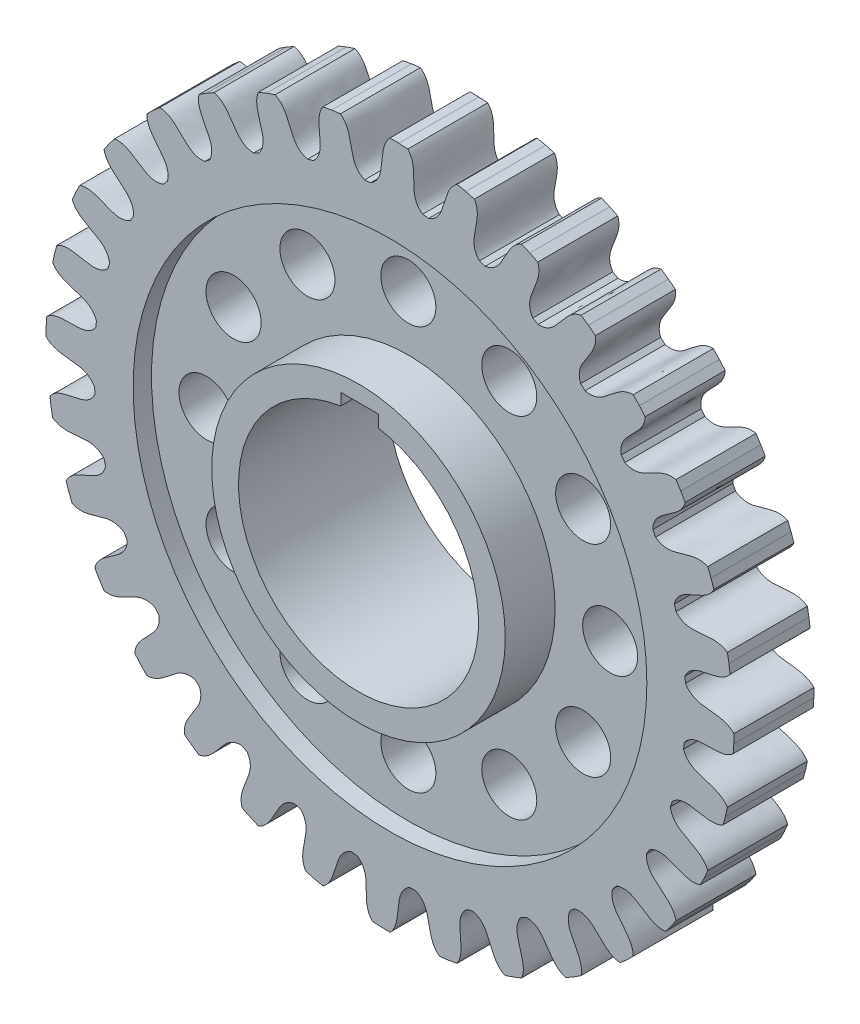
SolidWorks part; units mm, degrees
ref_plane "Ebene vorne" through (0, 0, 0) normal (0, 0, 1) x (1, 0, 0)
ref_plane "Ebene oben" through (0, 0, 0) normal (0, 1, 0) x (1, 0, 0)
ref_plane "Ebene rechts" through (0, 0, 0) normal (1, 0, 0) x (0, 0, -1)
ref_plane "Ebene1" through (0, 0, 13.081) normal (0, 0, 1) x (1, 0, 0)
sketch "Skizze1" plane through (0, 0, 13.081) normal (0, 0, 1) x (1, 0, 0)
  line L0 (22.8551, 51.3844) -> (21.5214, 51.9571)
  line L1 (13.7916, 54.4737) -> (12.3913, 54.8559)
  line L2 (12.3913, 54.8559) -> (10.9715, 55.1574)
  line L3 (2.8993, 56.1176) -> (1.4514, 56.2193)
  line L4 (1.4514, 56.2193) -> (0, 56.238)
  line L5 (-8.1044, 55.6049) -> (-9.5444, 55.4222)
  line L6 (-9.5444, 55.4222) -> (-10.9715, 55.1574)
  line L7 (-18.7967, 52.9554) -> (-20.1733, 52.4952)
  line L8 (-20.1733, 52.4952) -> (-21.5214, 51.9571)
  line L9 (-28.7666, 48.2708) -> (-30.027, 47.5509)
  line L10 (-30.027, 47.5509) -> (-31.2442, 46.7602)
  line L11 (-37.631, 41.7312) -> (-38.7268, 40.7793)
  line L12 (-38.7268, 40.7793) -> (-39.7663, 39.7663)
  line L13 (-45.0493, 33.5879) -> (-45.9383, 32.4405)
  line L14 (-45.9383, 32.4405) -> (-46.7602, 31.2442)
  line L15 (-50.7364, 24.1539) -> (-51.3844, 22.8551)
  line L16 (-51.3844, 22.8551) -> (-51.9571, 21.5214)
  line L17 (-54.4737, 13.7916) -> (-54.8559, 12.3913)
  line L18 (-54.8559, 12.3913) -> (-55.1574, 10.9715)
  line L19 (-56.1176, 2.8993) -> (-56.2193, 1.4514)
  line L20 (-56.2193, 1.4514) -> (-56.238, 0)
  line L21 (-55.6049, -8.1044) -> (-55.4222, -9.5444)
  line L22 (-55.4222, -9.5444) -> (-55.1574, -10.9715)
  line L23 (-52.9554, -18.7967) -> (-52.4952, -20.1733)
  line L24 (-52.4952, -20.1733) -> (-51.9571, -21.5214)
  line L25 (-48.2708, -28.7666) -> (-47.5509, -30.027)
  line L26 (-47.5509, -30.027) -> (-46.7602, -31.2442)
  line L27 (-41.7312, -37.631) -> (-40.7793, -38.7268)
  line L28 (-40.7793, -38.7268) -> (-39.7663, -39.7663)
  line L29 (-33.5879, -45.0493) -> (-32.4405, -45.9383)
  line L30 (-32.4405, -45.9383) -> (-31.2442, -46.7602)
  line L31 (-24.1539, -50.7364) -> (-22.8551, -51.3844)
  line L32 (-22.8551, -51.3844) -> (-21.5214, -51.9571)
  line L33 (-13.7916, -54.4737) -> (-12.3913, -54.8559)
  line L34 (-12.3913, -54.8559) -> (-10.9715, -55.1574)
  line L35 (-2.8993, -56.1176) -> (-1.4514, -56.2193)
  line L36 (-1.4514, -56.2193) -> (0, -56.238)
  line L37 (8.1044, -55.6049) -> (9.5444, -55.4222)
  line L38 (9.5444, -55.4222) -> (10.9715, -55.1574)
  line L39 (18.7967, -52.9554) -> (20.1733, -52.4952)
  line L40 (20.1733, -52.4952) -> (21.5214, -51.9571)
  line L41 (28.7666, -48.2708) -> (30.027, -47.5509)
  line L42 (30.027, -47.5509) -> (31.2442, -46.7602)
  line L43 (37.631, -41.7312) -> (38.7268, -40.7793)
  line L44 (38.7268, -40.7793) -> (39.7663, -39.7663)
  line L45 (45.0493, -33.5879) -> (45.9383, -32.4405)
  line L46 (45.9383, -32.4405) -> (46.7602, -31.2442)
  line L47 (50.7364, -24.1539) -> (51.3844, -22.8551)
  line L48 (51.3844, -22.8551) -> (51.9571, -21.5214)
  line L49 (54.4737, -13.7916) -> (54.8559, -12.3913)
  line L50 (54.8559, -12.3913) -> (55.1574, -10.9715)
  line L51 (56.1176, -2.8993) -> (56.2193, -1.4514)
  line L52 (56.2193, -1.4514) -> (56.238, 0)
  line L53 (55.6049, 8.1044) -> (55.4222, 9.5444)
  line L54 (55.4222, 9.5444) -> (55.1574, 10.9715)
  line L55 (52.9554, 18.7967) -> (52.4952, 20.1733)
  line L56 (52.4952, 20.1733) -> (51.9571, 21.5214)
  line L57 (48.2708, 28.7666) -> (47.5509, 30.027)
  line L58 (47.5509, 30.027) -> (46.7602, 31.2442)
  line L59 (41.7312, 37.631) -> (40.7793, 38.7268)
  line L60 (40.7793, 38.7268) -> (39.7663, 39.7663)
  line L61 (33.5879, 45.0493) -> (32.4405, 45.9383)
  line L62 (32.4405, 45.9383) -> (31.2442, 46.7602)
  line L63 (24.1539, 50.7364) -> (22.8551, 51.3844)
  arc A0 (15.5547, 45.843) -> (14.6243, 46.1482) centre (0, 0) ccw
  arc A1 (6.3123, 47.9967) -> (5.3402, 48.1146) centre (0, 0) ccw
  arc A2 (-3.1727, 48.3059) -> (-4.1491, 48.2319) centre (0, 0) ccw
  arc A3 (-12.5358, 46.7588) -> (-13.4789, 46.4957) centre (0, 0) ccw
  arc A4 (-21.4171, 43.4147) -> (-22.2908, 42.9726) centre (0, 0) ccw
  arc A5 (-29.4753, 38.4022) -> (-30.246, 37.7982) centre (0, 0) ccw
  arc A6 (-36.4009, 31.914) -> (-37.0389, 31.1712) centre (0, 0) ccw
  arc A7 (-41.9276, 24.1993) -> (-42.4084, 23.3463) centre (0, 0) ccw
  arc A8 (-45.843, 15.5547) -> (-46.1482, 14.6243) centre (0, 0) ccw
  arc A9 (-47.9967, 6.3123) -> (-48.1146, 5.3402) centre (0, 0) ccw
  arc A10 (-48.3059, -3.1727) -> (-48.2319, -4.1491) centre (0, 0) ccw
  arc A11 (-46.7588, -12.5358) -> (-46.4957, -13.4789) centre (0, 0) ccw
  arc A12 (-43.4147, -21.4171) -> (-42.9726, -22.2908) centre (0, 0) ccw
  arc A13 (-38.4022, -29.4753) -> (-37.7982, -30.246) centre (0, 0) ccw
  arc A14 (-31.914, -36.4009) -> (-31.1712, -37.0389) centre (0, 0) ccw
  arc A15 (-24.1993, -41.9276) -> (-23.3463, -42.4084) centre (0, 0) ccw
  arc A16 (-15.5547, -45.843) -> (-14.6243, -46.1482) centre (0, 0) ccw
  arc A17 (-6.3123, -47.9967) -> (-5.3402, -48.1146) centre (0, 0) ccw
  arc A18 (3.1727, -48.3059) -> (4.1491, -48.2319) centre (0, 0) ccw
  arc A19 (12.5358, -46.7588) -> (13.4789, -46.4957) centre (0, 0) ccw
  arc A20 (21.4171, -43.4147) -> (22.2908, -42.9726) centre (0, 0) ccw
  arc A21 (29.4753, -38.4022) -> (30.246, -37.7982) centre (0, 0) ccw
  arc A22 (36.4009, -31.914) -> (37.0389, -31.1712) centre (0, 0) ccw
  arc A23 (41.9276, -24.1993) -> (42.4084, -23.3463) centre (0, 0) ccw
  arc A24 (45.843, -15.5547) -> (46.1482, -14.6243) centre (0, 0) ccw
  arc A25 (47.9967, -6.3123) -> (48.1146, -5.3402) centre (0, 0) ccw
  arc A26 (48.3059, 3.1727) -> (48.2319, 4.1491) centre (0, 0) ccw
  arc A27 (46.7588, 12.5358) -> (46.4957, 13.4789) centre (0, 0) ccw
  arc A28 (43.4147, 21.4171) -> (42.9726, 22.2908) centre (0, 0) ccw
  arc A29 (38.4022, 29.4753) -> (37.7982, 30.246) centre (0, 0) ccw
  arc A30 (31.914, 36.4009) -> (31.1712, 37.0389) centre (0, 0) ccw
  arc A31 (24.1993, 41.9276) -> (23.3463, 42.4084) centre (0, 0) ccw
  spline S0 degree 3 poles (15.5547, 45.843) (18.8964, 46.3217) (18.6134, 50.7789) (21.5214, 51.9571) knots 0 0 0 0 1 1 1 1
  spline S1 degree 3 poles (13.7916, 54.4737) (15.4092, 51.8254) (12.3088, 48.5164) (14.6243, 46.1482) knots 0 0 0 0 1 1 1 1
  spline S2 degree 3 poles (6.3123, 47.9967) (9.4964, 49.1181) (8.3493, 53.4345) (10.9715, 55.1574) knots 0 0 0 0 1 1 1 1
  spline S3 degree 3 poles (2.8993, 56.1176) (5.0025, 53.8358) (2.6072, 49.9855) (5.3402, 48.1146) knots 0 0 0 0 1 1 1 1
  spline S4 degree 3 poles (-3.1727, 48.3059) (-0.2685, 50.027) (-2.2357, 54.0366) (0, 56.238) knots 0 0 0 0 1 1 1 1
  spline S5 degree 3 poles (-8.1044, 55.6049) (-5.5965, 53.7773) (-7.1946, 49.5337) (-4.1491, 48.2319) knots 0 0 0 0 1 1 1 1
  spline S6 degree 3 poles (-12.5358, 46.7588) (-10.0231, 49.0134) (-12.7348, 52.5621) (-10.9715, 55.1574) knots 0 0 0 0 1 1 1 1
  spline S7 degree 3 poles (-18.7967, 52.9554) (-15.9804, 51.6522) (-16.7199, 47.1783) (-13.4789, 46.4957) knots 0 0 0 0 1 1 1 1
  spline S8 degree 3 poles (-21.4171, 43.4147) (-19.3926, 46.1162) (-22.7445, 49.0677) (-21.5214, 51.9571) knots 0 0 0 0 1 1 1 1
  spline S9 degree 3 poles (-28.7666, 48.2708) (-25.7502, 47.5421) (-25.6027, 43.0099) (-22.2908, 42.9726) knots 0 0 0 0 1 1 1 1
  spline S10 degree 3 poles (-29.4753, 38.4022) (-28.0168, 41.4468) (-31.8801, 43.6877) (-31.2442, 46.7602) knots 0 0 0 0 1 1 1 1
  spline S11 degree 3 poles (-37.631, 41.7312) (-34.5304, 41.6049) (-33.5015, 37.1886) (-30.246, 37.7982) knots 0 0 0 0 1 1 1 1
  spline S12 degree 3 poles (-36.4009, 31.914) (-35.5643, 35.1846) (-39.7906, 36.6288) (-39.7663, 39.7663) knots 0 0 0 0 1 1 1 1
  spline S13 degree 3 poles (-45.0493, 33.5879) (-41.9836, 34.069) (-40.1129, 29.9382) (-37.0389, 31.1712) knots 0 0 0 0 1 1 1 1
  spline S14 degree 3 poles (-41.9276, 24.1993) (-41.7451, 27.5703) (-46.1719, 28.1622) (-46.7602, 31.2442) knots 0 0 0 0 1 1 1 1
  spline S15 degree 3 poles (-50.7364, 24.1539) (-47.8235, 25.2237) (-45.1828, 21.5373) (-42.4084, 23.3463) knots 0 0 0 0 1 1 1 1
  spline S16 degree 3 poles (-45.843, 15.5547) (-46.3217, 18.8964) (-50.7789, 18.6134) (-51.9571, 21.5214) knots 0 0 0 0 1 1 1 1
  spline S17 degree 3 poles (-54.4737, 13.7916) (-51.8254, 15.4092) (-48.5164, 12.3088) (-46.1482, 14.6243) knots 0 0 0 0 1 1 1 1
  spline S18 degree 3 poles (-47.9967, 6.3123) (-49.1181, 9.4964) (-53.4345, 8.3493) (-55.1574, 10.9715) knots 0 0 0 0 1 1 1 1
  spline S19 degree 3 poles (-56.1176, 2.8993) (-53.8358, 5.0025) (-49.9855, 2.6072) (-48.1146, 5.3402) knots 0 0 0 0 1 1 1 1
  spline S20 degree 3 poles (-48.3059, -3.1727) (-50.027, -0.2685) (-54.0366, -2.2357) (-56.238, 0) knots 0 0 0 0 1 1 1 1
  spline S21 degree 3 poles (-55.6049, -8.1044) (-53.7773, -5.5965) (-49.5337, -7.1946) (-48.2319, -4.1491) knots 0 0 0 0 1 1 1 1
  spline S22 degree 3 poles (-46.7588, -12.5358) (-49.0134, -10.0231) (-52.5621, -12.7348) (-55.1574, -10.9715) knots 0 0 0 0 1 1 1 1
  spline S23 degree 3 poles (-52.9554, -18.7967) (-51.6522, -15.9804) (-47.1783, -16.7199) (-46.4957, -13.4789) knots 0 0 0 0 1 1 1 1
  spline S24 degree 3 poles (-43.4147, -21.4171) (-46.1162, -19.3926) (-49.0677, -22.7445) (-51.9571, -21.5214) knots 0 0 0 0 1 1 1 1
  spline S25 degree 3 poles (-48.2708, -28.7666) (-47.5421, -25.7502) (-43.0099, -25.6027) (-42.9726, -22.2908) knots 0 0 0 0 1 1 1 1
  spline S26 degree 3 poles (-38.4022, -29.4753) (-41.4468, -28.0168) (-43.6877, -31.8801) (-46.7602, -31.2442) knots 0 0 0 0 1 1 1 1
  spline S27 degree 3 poles (-41.7312, -37.631) (-41.6049, -34.5304) (-37.1886, -33.5015) (-37.7982, -30.246) knots 0 0 0 0 1 1 1 1
  spline S28 degree 3 poles (-31.914, -36.4009) (-35.1846, -35.5643) (-36.6288, -39.7906) (-39.7663, -39.7663) knots 0 0 0 0 1 1 1 1
  spline S29 degree 3 poles (-33.5879, -45.0493) (-34.069, -41.9836) (-29.9382, -40.1129) (-31.1712, -37.0389) knots 0 0 0 0 1 1 1 1
  spline S30 degree 3 poles (-24.1993, -41.9276) (-27.5703, -41.7451) (-28.1622, -46.1719) (-31.2442, -46.7602) knots 0 0 0 0 1 1 1 1
  spline S31 degree 3 poles (-24.1539, -50.7364) (-25.2237, -47.8235) (-21.5373, -45.1828) (-23.3463, -42.4084) knots 0 0 0 0 1 1 1 1
  spline S32 degree 3 poles (-15.5547, -45.843) (-18.8964, -46.3217) (-18.6134, -50.7789) (-21.5214, -51.9571) knots 0 0 0 0 1 1 1 1
  spline S33 degree 3 poles (-13.7916, -54.4737) (-15.4092, -51.8254) (-12.3088, -48.5164) (-14.6243, -46.1482) knots 0 0 0 0 1 1 1 1
  spline S34 degree 3 poles (-6.3123, -47.9967) (-9.4964, -49.1181) (-8.3493, -53.4345) (-10.9715, -55.1574) knots 0 0 0 0 1 1 1 1
  spline S35 degree 3 poles (-2.8993, -56.1176) (-5.0025, -53.8358) (-2.6072, -49.9855) (-5.3402, -48.1146) knots 0 0 0 0 1 1 1 1
  spline S36 degree 3 poles (3.1727, -48.3059) (0.2685, -50.027) (2.2357, -54.0366) (0, -56.238) knots 0 0 0 0 1 1 1 1
  spline S37 degree 3 poles (8.1044, -55.6049) (5.5965, -53.7773) (7.1946, -49.5337) (4.1491, -48.2319) knots 0 0 0 0 1 1 1 1
  spline S38 degree 3 poles (12.5358, -46.7588) (10.0231, -49.0134) (12.7348, -52.5621) (10.9715, -55.1574) knots 0 0 0 0 1 1 1 1
  spline S39 degree 3 poles (18.7967, -52.9554) (15.9804, -51.6522) (16.7199, -47.1783) (13.4789, -46.4957) knots 0 0 0 0 1 1 1 1
  spline S40 degree 3 poles (21.4171, -43.4147) (19.3926, -46.1162) (22.7445, -49.0677) (21.5214, -51.9571) knots 0 0 0 0 1 1 1 1
  spline S41 degree 3 poles (28.7666, -48.2708) (25.7502, -47.5421) (25.6027, -43.0099) (22.2908, -42.9726) knots 0 0 0 0 1 1 1 1
  spline S42 degree 3 poles (29.4753, -38.4022) (28.0168, -41.4468) (31.8801, -43.6877) (31.2442, -46.7602) knots 0 0 0 0 1 1 1 1
  spline S43 degree 3 poles (37.631, -41.7312) (34.5304, -41.6049) (33.5015, -37.1886) (30.246, -37.7982) knots 0 0 0 0 1 1 1 1
  spline S44 degree 3 poles (36.4009, -31.914) (35.5643, -35.1846) (39.7906, -36.6288) (39.7663, -39.7663) knots 0 0 0 0 1 1 1 1
  spline S45 degree 3 poles (45.0493, -33.5879) (41.9836, -34.069) (40.1129, -29.9382) (37.0389, -31.1712) knots 0 0 0 0 1 1 1 1
  spline S46 degree 3 poles (41.9276, -24.1993) (41.7451, -27.5703) (46.1719, -28.1622) (46.7602, -31.2442) knots 0 0 0 0 1 1 1 1
  spline S47 degree 3 poles (50.7364, -24.1539) (47.8235, -25.2237) (45.1828, -21.5373) (42.4084, -23.3463) knots 0 0 0 0 1 1 1 1
  spline S48 degree 3 poles (45.843, -15.5547) (46.3217, -18.8964) (50.7789, -18.6134) (51.9571, -21.5214) knots 0 0 0 0 1 1 1 1
  spline S49 degree 3 poles (54.4737, -13.7916) (51.8254, -15.4092) (48.5164, -12.3088) (46.1482, -14.6243) knots 0 0 0 0 1 1 1 1
  spline S50 degree 3 poles (47.9967, -6.3123) (49.1181, -9.4964) (53.4345, -8.3493) (55.1574, -10.9715) knots 0 0 0 0 1 1 1 1
  spline S51 degree 3 poles (56.1176, -2.8993) (53.8358, -5.0025) (49.9855, -2.6072) (48.1146, -5.3402) knots 0 0 0 0 1 1 1 1
  spline S52 degree 3 poles (48.3059, 3.1727) (50.027, 0.2685) (54.0366, 2.2357) (56.238, 0) knots 0 0 0 0 1 1 1 1
  spline S53 degree 3 poles (55.6049, 8.1044) (53.7773, 5.5965) (49.5337, 7.1946) (48.2319, 4.1491) knots 0 0 0 0 1 1 1 1
  spline S54 degree 3 poles (46.7588, 12.5358) (49.0134, 10.0231) (52.5621, 12.7348) (55.1574, 10.9715) knots 0 0 0 0 1 1 1 1
  spline S55 degree 3 poles (52.9554, 18.7967) (51.6522, 15.9804) (47.1783, 16.7199) (46.4957, 13.4789) knots 0 0 0 0 1 1 1 1
  spline S56 degree 3 poles (43.4147, 21.4171) (46.1162, 19.3926) (49.0677, 22.7445) (51.9571, 21.5214) knots 0 0 0 0 1 1 1 1
  spline S57 degree 3 poles (48.2708, 28.7666) (47.5421, 25.7502) (43.0099, 25.6027) (42.9726, 22.2908) knots 0 0 0 0 1 1 1 1
  spline S58 degree 3 poles (38.4022, 29.4753) (41.4468, 28.0168) (43.6877, 31.8801) (46.7602, 31.2442) knots 0 0 0 0 1 1 1 1
  spline S59 degree 3 poles (41.7312, 37.631) (41.6049, 34.5304) (37.1886, 33.5015) (37.7982, 30.246) knots 0 0 0 0 1 1 1 1
  spline S60 degree 3 poles (31.914, 36.4009) (35.1846, 35.5643) (36.6288, 39.7906) (39.7663, 39.7663) knots 0 0 0 0 1 1 1 1
  spline S61 degree 3 poles (33.5879, 45.0493) (34.069, 41.9836) (29.9382, 40.1129) (31.1712, 37.0389) knots 0 0 0 0 1 1 1 1
  spline S62 degree 3 poles (24.1993, 41.9276) (27.5703, 41.7451) (28.1622, 46.1719) (31.2442, 46.7602) knots 0 0 0 0 1 1 1 1
  spline S63 degree 3 poles (24.1539, 50.7364) (25.2237, 47.8235) (21.5373, 45.1828) (23.3463, 42.4084) knots 0 0 0 0 1 1 1 1
extrude "Aufsatz-Linear austragen1" add sketch "Skizze1" against normal blind 13.081
sketch "Skizze2" plane through (0, 0, 13.081) normal (0, 0, 1) x (1, 0, 0)
  circle A0 centre (0, 0) radius 24
  dimension "D1" = 48
extrude "Aufsatz-Linear austragen2" add sketch "Skizze2" along normal blind 5.15
sketch "Skizze3" plane through (0, 0, 0) normal (0, 0, -1) x (-1, 0, 0)
  circle A0 centre (0, 0) radius 24
  dimension "D1" = 48
extrude "Aufsatz-Linear austragen3" add sketch "Skizze3" along normal blind 6.18
sketch "Skizze4" plane through (0, 0, -6.18) normal (0, 0, -1) x (-1, 0, 0)
  line L0 (2.898, 21.3451) -> (-3.282, 21.3451)
  line L1 (-3.282, 21.3451) -> (-3.282, 19.3451)
  line L2 (2.898, 19.4063) -> (2.898, 21.3451)
  arc A0 (-3.282, 19.3451) -> (2.898, 19.4063) centre (0, 0) cw
  dimension "D1" = 2
extrude "Schnitt-Linear austragen1" cut sketch "Skizze4" against normal through all
sketch "Skizze5" plane through (0, 0, 0) normal (0, 1, 0) x (1, 0, 0)
  line L0 (19.6215, 6.18) -> (0, 6.18)
  line L1 (0, 6.18) -> (0, -18.231)
  line L2 (0, -18.231) -> (19.6215, -18.231)
  line L3 (19.6215, -18.231) -> (19.6215, 6.18)
  line L4 (0, 6.18) -> (0, -18.231) construction
revolve "Schnitt-Rotation1" cut sketch "Skizze5" angle 360 about L4
sketch "Skizze6" plane through (0, 0, 13.081) normal (0, 0, 1) x (1, 0, 0)
  circle A1 centre (0, 0) radius 24
  circle A2 centre (0, 0) radius 42
  dimension "D2" = 48
  dimension "D1" = 18
extrude "Schnitt-Linear austragen2" cut sketch "Skizze6" against normal blind 3
sketch "Skizze10" plane through (0, 0, 0) normal (0, 0, -1) x (-1, 0, 0)
  circle A2 centre (0, 0) radius 24
  circle A3 centre (0, 0) radius 42.05
  dimension "D1" = 48
extrude "Schnitt-Linear austragen6" cut sketch "Skizze10" against normal blind 3
sketch "Skizze9" plane through (0, 0, 0) normal (0, 0, -1) x (-1, 0, 0)
  line L0 (0, -3.3158) -> (0, 3.3158) construction
  line L1 (-25.1858, 0) -> (25.1858, 0) construction
  circle A1 centre (0, 33) radius 4.5
  circle A2 centre (16.5, 28.5788) radius 4.5
  circle A3 centre (28.5788, 16.5) radius 4.5
  circle A4 centre (33, 0) radius 4.5
  circle A5 centre (28.5788, -16.5) radius 4.5
  circle A6 centre (16.5, -28.5788) radius 4.5
  circle A7 centre (0, -33) radius 4.5
  circle A8 centre (-16.5, -28.5788) radius 4.5
  circle A9 centre (-28.5788, -16.5) radius 4.5
  circle A10 centre (-33, 0) radius 4.5
  circle A11 centre (-28.5788, 16.5) radius 4.5
  circle A12 centre (-16.5, 28.5788) radius 4.5
  arc A15 (-3.282, 19.3451) -> (2.898, 19.4063) centre (0, 0) ccw construction
  point P34 (0, 0)
  dimension "D1" = 9
  dimension "D2" = 33
  dimension "D3" = 12
extrude "Schnitt-Linear austragen5" cut sketch "Skizze9" against normal through all
